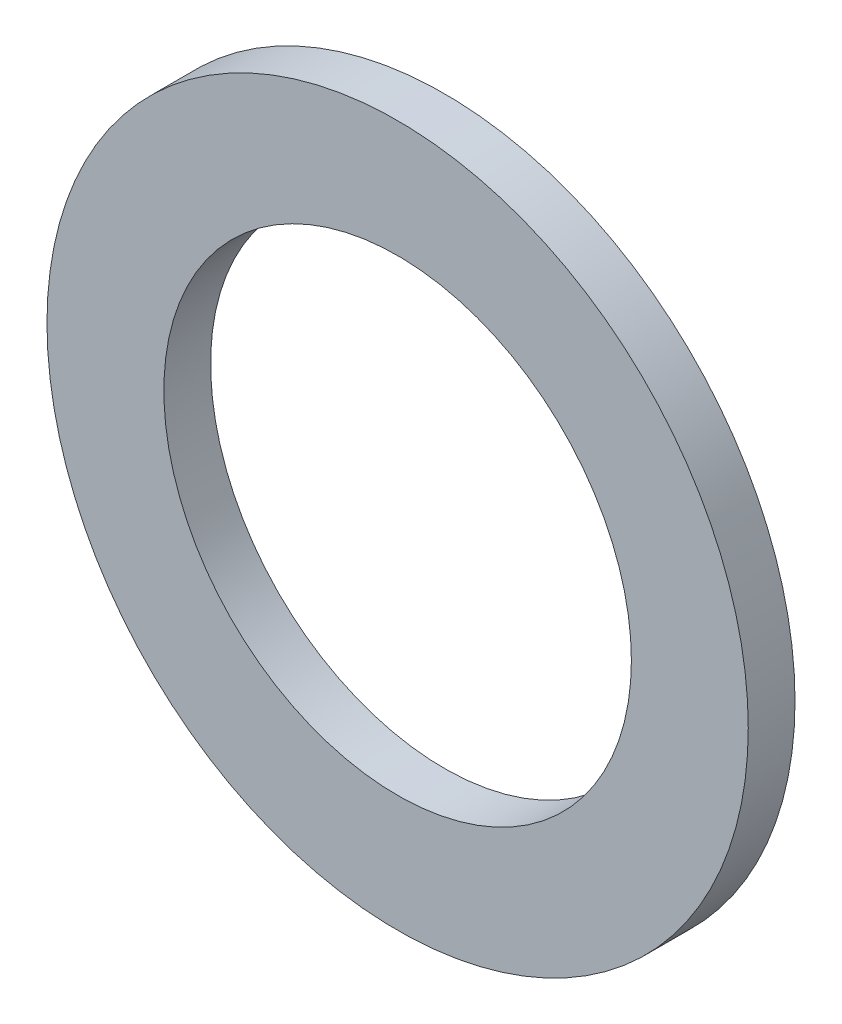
SolidWorks part; units mm, degrees
ref_plane "前视" through (0, 0, 0) normal (0, 0, 1) x (1, 0, 0)
ref_plane "上视" through (0, 0, 0) normal (0, 1, 0) x (1, 0, 0)
ref_plane "右视" through (0, 0, 0) normal (1, 0, 0) x (0, 0, -1)
sketch "草图1" plane through (0, 0, 0) normal (0, 0, 1) x (1, 0, 0)
  circle A0 centre (0, 0) radius 10
  circle A1 centre (0, 0) radius 15
  dimension "D1" = 30
  dimension "D2" = 20
extrude "拉伸1" add sketch "草图1" along normal blind 2
